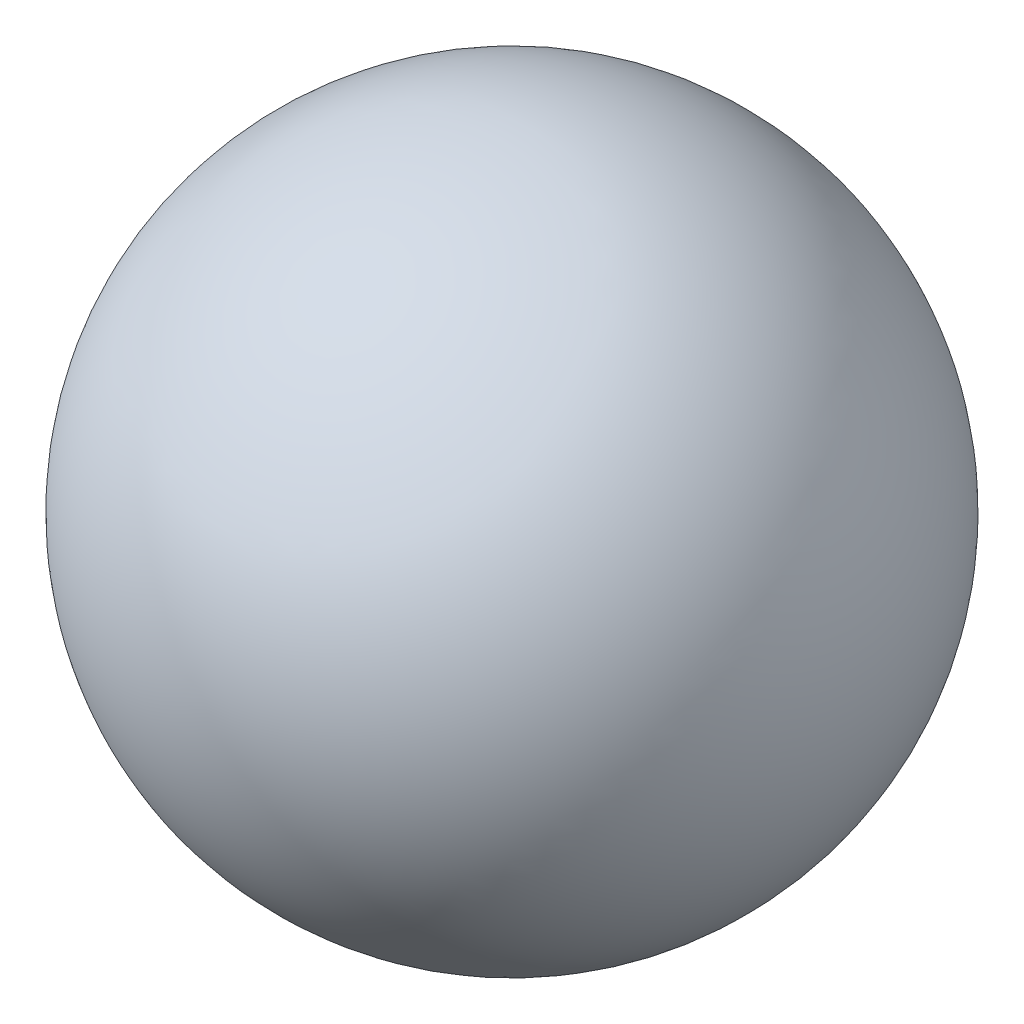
SolidWorks part; units mm, degrees
ref_plane "前视基准面" through (0, 0, 0) normal (0, 0, 1) x (1, 0, 0)
ref_plane "上视基准面" through (0, 0, 0) normal (0, 1, 0) x (1, 0, 0)
ref_plane "右视基准面" through (0, 0, 0) normal (1, 0, 0) x (0, 0, -1)
sketch "草图1" plane through (0, 0, 0) normal (0, 1, 0) x (1, 0, 0)
  line L0 (0, 78.4412) -> (0, -64.9941) construction
  line L1 (0, 46.7235) -> (0, -33.2765)
  arc A0 (0, 46.7235) -> (0, -33.2765) centre (0, 6.7235) ccw
  dimension "D1" = 40
revolve "旋转1" add sketch "草图1" angle 360 about L0
